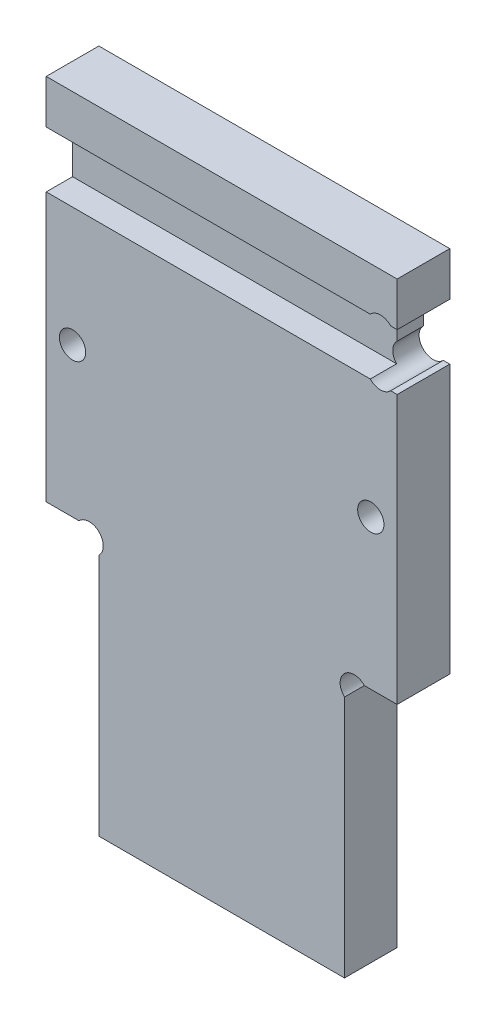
SolidWorks part; units mm, degrees
ref_plane "Face" through (0, 0, 0) normal (0, 0, 1) x (1, 0, 0)
ref_plane "Dessus" through (0, 0, 0) normal (0, 1, 0) x (1, 0, 0)
ref_plane "Droite" through (0, 0, 0) normal (1, 0, 0) x (0, 0, -1)
sketch "Esquisse1" plane through (0, 0, 0) normal (0, 0, 1) x (1, 0, 0)
  line L1 (-33.3423, 47.9735) -> (6.6577, 47.9735)
  line L2 (-33.3423, 47.9735) -> (-33.3423, -24.0265)
  line L3 (-33.3423, -24.0265) -> (6.6577, -24.0265)
  line L4 (6.6577, 47.9735) -> (6.6577, -24.0265)
  dimension "D1" = 40
  dimension "D2" = 72
extrude "Base-Extrusion" add sketch "Esquisse1" along normal blind 6
sketch "Esquisse2" plane through (0, 0, 6) normal (0, 0, 1) x (1, 0, 0)
  line L0 (-33.3423, 47.9735) -> (-33.3423, -24.0265) construction
  line L1 (-33.3423, 42.9735) -> (6.6577, 42.9735)
  line L2 (-33.3423, 42.9735) -> (-33.3423, 36.5735)
  line L3 (-33.3423, 36.5735) -> (6.6577, 36.5735)
  line L4 (6.6577, 42.9735) -> (6.6577, 36.5735)
  line L5 (6.6577, -24.0265) -> (6.6577, 47.9735) construction
  line L7 (-33.3423, -24.0265) -> (6.6577, -24.0265) construction
  dimension "D1" = 67
  dimension "D2" = 6.4
extrude "Enlèv. mat.-Extru.1" cut sketch "Esquisse2" against normal blind 3
sketch "Esquisse3" plane through (0, 0, 6) normal (0, 0, 1) x (1, 0, 0)
  line L0 (-33.3423, 36.5735) -> (-33.3423, -24.0265) construction
  line L1 (6.6577, -24.0265) -> (6.6577, 36.5735) construction
  line L3 (6.6577, 47.9735) -> (-33.3423, 47.9735) construction
  circle A0 centre (3.6577, 22.9735) radius 1.5
  circle A1 centre (-30.3423, 22.9735) radius 1.5
  dimension "D1" = 3
  dimension "D2" = 3
  dimension "D5" = 3
  dimension "D3" = 25
  dimension "D4" = 3
  dimension "D6" = 25
extrude "Enlèv. mat.-Extru.2" cut sketch "Esquisse3" against normal up to vertex
sketch "Esquisse4" plane through (0, 0, 6) normal (0, 0, 1) x (1, 0, 0)
  line L1 (-33.3423, -24.0265) -> (-27.3423, -24.0265)
  line L2 (-33.3423, -24.0265) -> (-33.3423, 5.9735)
  line L3 (-33.3423, 5.9735) -> (-27.3423, 5.9735)
  line L4 (-27.3423, -24.0265) -> (-27.3423, 5.9735)
  line L5 (6.6577, -24.0265) -> (0.6577, -24.0265)
  line L6 (6.6577, -24.0265) -> (6.6577, 5.9735)
  line L7 (6.6577, 5.9735) -> (0.6577, 5.9735)
  line L8 (0.6577, -24.0265) -> (0.6577, 5.9735)
  dimension "D1" = 6
  dimension "D2" = 6
  dimension "D3" = 30
  dimension "D4" = 30
extrude "Enlèv. mat.-Extru.3" cut sketch "Esquisse4" against normal up to vertex
sketch "Esquisse6" plane through (0, 0, 3) normal (0, 0, 1) x (1, 0, 0)
  line L0 (-33.3423, 36.5735) -> (6.6577, 36.5735) construction
  line L1 (6.6577, 42.9735) -> (3.6577, 42.9735)
  line L2 (6.6577, 42.9735) -> (6.6577, 36.5735)
  line L3 (6.6577, 36.5735) -> (3.6577, 36.5735)
  line L4 (3.6577, 42.9735) -> (3.6577, 36.5735)
  dimension "D1" = 3
extrude "Enlèv. mat.-Extru.5" cut sketch "Esquisse6" against normal up to vertex (3 mm away)
sketch "Esquisse5" plane through (0, 0, 6) normal (0, 0, 1) x (1, 0, 0)
  line L0 (-27.3423, -24.0265) -> (-27.3423, 5.9735) construction
  line L1 (0.6577, 5.9735) -> (0.6577, -24.0265) construction
  line L2 (6.6577, 5.9735) -> (0.6577, 5.9735) construction
  line L3 (-27.3423, 5.9735) -> (-33.3423, 5.9735) construction
  line L4 (3.6577, 42.9735) -> (3.6577, 36.5735) construction
  line L5 (-33.3423, 36.5735) -> (6.6577, 36.5735) construction
  line L6 (6.6577, 42.9735) -> (-33.3423, 42.9735) construction
  circle A0 centre (-28.4423, 4.8735) radius 1.6
  circle A1 centre (1.7577, 4.8735) radius 1.6
  circle A2 centre (4.7577, 41.8735) radius 1.6
  circle A3 centre (4.7577, 37.6735) radius 1.6
  dimension "D1" = 1.1
  dimension "D5" = 1.1
  dimension "D2" = 1.1
  dimension "D3" = 1.1
  dimension "D4" = 1.1
  dimension "D6" = 1.1
  dimension "D7" = 1.1
  dimension "D8" = 1.1
extrude "Enlèv. mat.-Extru.4" cut sketch "Esquisse5" against normal up to vertex
